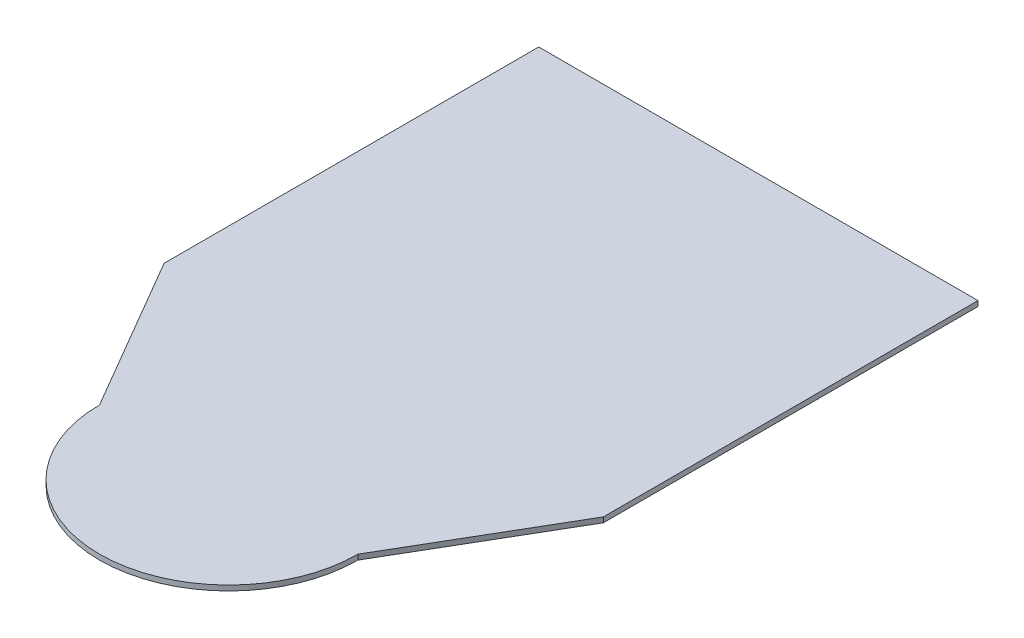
SolidWorks part; units mm, degrees
ref_plane "Front Plane" through (0, 0, 0) normal (0, 0, 1) x (1, 0, 0)
ref_plane "Top Plane" through (0, 0, 0) normal (0, 1, 0) x (1, 0, 0)
ref_plane "Right Plane" through (0, 0, 0) normal (1, 0, 0) x (0, 0, -1)
sketch "Sketch1" plane through (0, 0, 0) normal (0, 1, 0) x (1, 0, 0)
  line L0 (-85, -72.5) -> (-50, -132.5)
  line L1 (85, -72.5) -> (-85, -72.5) construction
  line L2 (85, -72.5) -> (85, 72.5)
  line L3 (85, 72.5) -> (-85, 72.5)
  line L4 (-85, -72.5) -> (-85, 72.5)
  line L5 (85, -72.5) -> (-85, 72.5) construction
  line L6 (85, 72.5) -> (-85, -72.5) construction
  line L7 (85, -72.5) -> (50, -132.5)
  line L8 (-50, -132.5) -> (50, -132.5) construction
  line L9 (0, -132.5) -> (0, -72.5) construction
  arc A1 (-50, -132.5) -> (50, -132.5) centre (0, -132.5) ccw
  point P0 (0, 0)
  point P9 (0, -132.5)
  point P10 (60, -126.8739)
  dimension "D3" = 50
  dimension "D1" = 170
  dimension "D2" = 145
  dimension "D4" = 60
base flange "Base-Flange1" sketch "Sketch1" thickness 2 reverse thickness direction no parameters "D1"=2
sketch "Bend-Lines1" [suppressed] plane through (0, 0, 0) normal (0, 1, 0) x (1, 0, 0)
sketch "Bounding-Box1" [suppressed] plane through (0, 0, 0) normal (0, 1, 0) x (1, 0, 0)
sheet metal parameters "Sheet-Metal1" thickness 2 parameters "D1"=2
flat pattern "Flat-Pattern1"
sketch "Bend-Lines2" plane through (0, 0, 0) normal (0, 1, 0) x (1, 0, 0)
sketch3d "Bounding-Box2" [suppressed]
  line L0 (85, 205, 0) -> (85, -50, 0) construction
  line L1 (-85, 205, 0) -> (-85, -50, 0) construction
  line L2 (85, 205, 0) -> (-85, 205, 0) construction
  line L3 (85, -50, 0) -> (-85, -50, 0) construction
